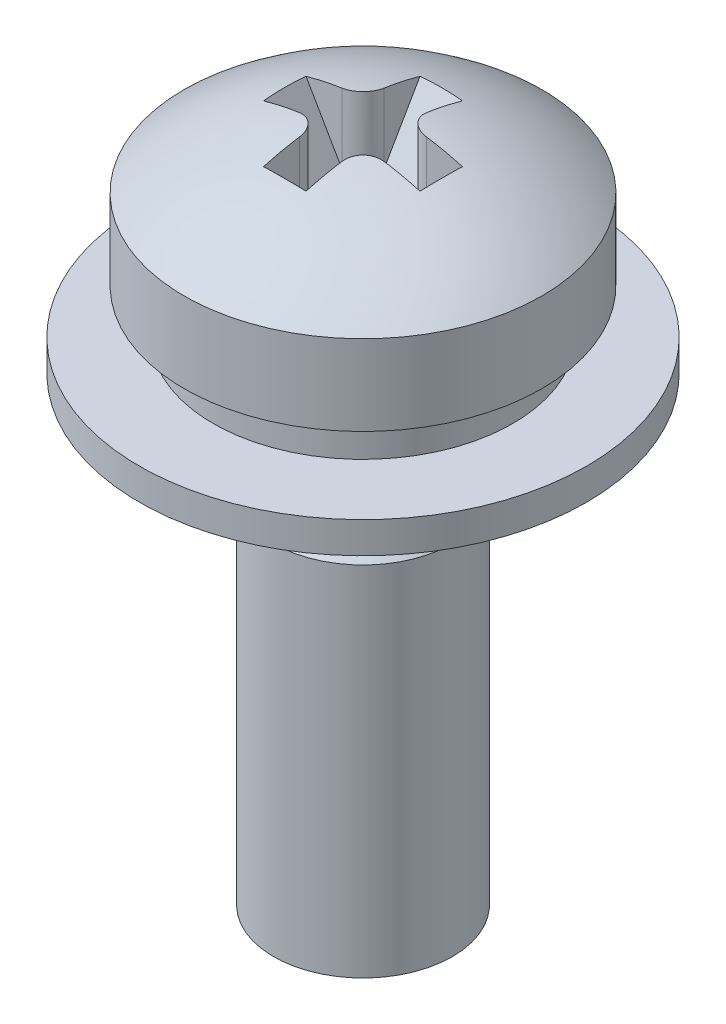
SolidWorks part; units mm, degrees
ref_plane "Front" through (0, 0, 0) normal (0, 0, 1) x (1, 0, 0)
ref_plane "Top" through (0, 0, 0) normal (0, 1, 0) x (1, 0, 0)
ref_plane "Right" through (0, 0, 0) normal (1, 0, 0) x (0, 0, -1)
sketch "草图1" plane through (0, 0, 0) normal (0, 0, 1) x (1, 0, 0)
  line L0 (0, -87.1169) -> (0, 4268.7266) construction
  line L1 (0, -7.6) -> (1, -7.6)
  line L2 (1, -7.6) -> (1, -3.6)
  line L3 (0.8, -1.6) -> (2, -1.6)
  line L4 (2, -1.6) -> (2, -0.702)
  line L5 (0, 0) -> (0, -7.6)
  line L6 (1, -3.6) -> (0.8, -3.4)
  line L7 (0.8, -3.4) -> (0.8, -1.6)
  arc A0 (2, -0.702) -> (0, 0) centre (0, -3.2) ccw
  dimension "rf" = 3.2
  dimension "d" = 2
  dimension "l" = 6
  dimension "dk" = 4
  dimension "k" = 1.6
  dimension "l1" = 2
  dimension "d2" = 1.6
  dimension "C" = 45
revolve "旋转1" add sketch "草图1" angle 360 about L0
sketch "草图2" plane through (0, 0, 0) normal (0, 1, 0) x (1, 0, 0)
  line L1 (0.2375, -0.95) -> (-0.2375, -0.95)
  line L2 (0.2375, -0.95) -> (0.2375, 0.95)
  line L3 (0.2375, 0.95) -> (-0.2375, 0.95)
  line L4 (-0.2375, -0.95) -> (-0.2375, 0.95)
  line L5 (0.2375, -0.95) -> (-0.2375, 0.95) construction
  line L6 (0.2375, 0.95) -> (-0.2375, -0.95) construction
  line L7 (-0.95, -0.2375) -> (0.95, -0.2375)
  line L8 (-0.95, -0.2375) -> (-0.95, 0.2375)
  line L9 (-0.95, 0.2375) -> (0.95, 0.2375)
  line L10 (0.95, -0.2375) -> (0.95, 0.2375)
  line L11 (-0.95, -0.2375) -> (0.95, 0.2375) construction
  line L12 (-0.95, 0.2375) -> (0.95, -0.2375) construction
  point P0 (0, 0)
  point P6 (0, 0)
  dimension "m" = 1.9
  dimension "m1" = 0.475
extrude "切除-拉伸1" cut sketch "草图2" against normal blind 1.2 contours L8 L9 L10 L7 | L1 L4 L3 L2
draft "拔模1" type of draft neutral plane draft angle 30 neutral plane "Top" faces to draft 4 parameters "m3"=30
fillet "圆角1" radius 0.2375 4 edges at (0.2375, -0.6088, 0.2375) (-0.2375, -0.6088, 0.2375) (0.2375, -0.6088, -0.2375) (-0.2375, -0.6088, -0.2375)
sketch "草图3" plane through (0, -1.6, 0) normal (0, -1, 0) x (1, 0, 0)
  circle A0 centre (0, 0) radius 1.675
  circle A1 centre (0, 0) radius 0.875
  dimension "d1" = 1.75
  dimension "b" = 0.8
extrude "凸台-拉伸1" add sketch "草图3" along normal blind 0.5
sketch "草图4" plane through (0, 0, 0) normal (0, 0, 1) x (1, 0, 0)
  line L0 (-0.0462, -1.6) -> (0.2038, -1.6)
  line L2 (-0.0462, -1.6) -> (-0.2038, -2.1)
  line L3 (0.2038, -1.6) -> (0.0462, -2.1)
  line L4 (-0.2038, -2.1) -> (0.0462, -2.1)
  line L5 (-1.675, -1.6) -> (1.675, -1.6) construction
  line L6 (-1.675, -2.1) -> (1.675, -2.1) construction
  line L7 (-0.0462, -1.6) -> (0.0462, -2.1) construction
  point P8 (0, -1.85)
  dimension "m" = 0.25
  dimension "D2" = 72.5
extrude "切除-拉伸2" cut sketch "草图4" against normal through all
other "删除面1"
sketch "草图5" plane through (0, -2.1, 0) normal (0, -1, 0) x (1, 0, 0)
  circle A0 centre (0, 0) radius 0.875
  circle A1 centre (0, 0) radius 2.5
  dimension "D1" = 1.75
  dimension "D2" = 5
extrude "凸台-拉伸2" add sketch "草图5" along normal blind 0.35
